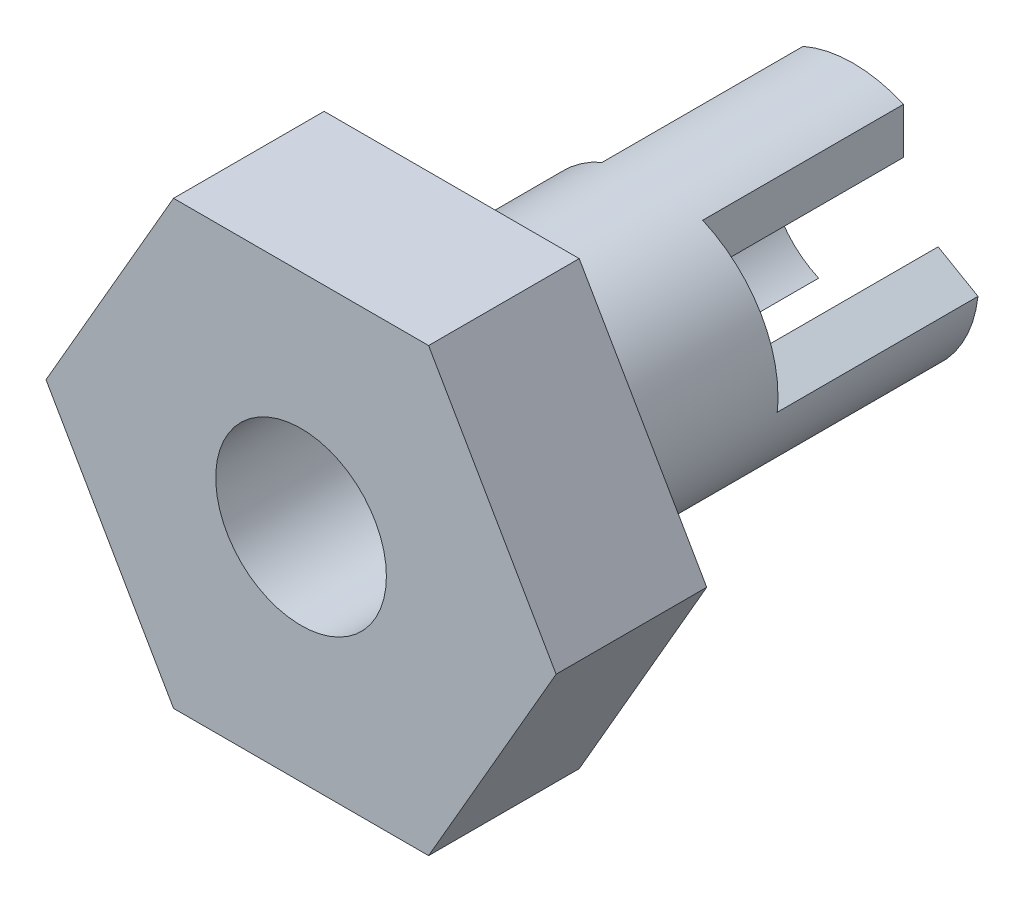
SolidWorks part; units mm, degrees
ref_plane "Front Plane" through (0, 0, 0) normal (0, 0, 1) x (1, 0, 0)
ref_plane "Top Plane" through (0, 0, 0) normal (0, 1, 0) x (1, 0, 0)
ref_plane "Right Plane" through (0, 0, 0) normal (1, 0, 0) x (0, 0, -1)
sketch "Sketch1" plane through (0, 0, 0) normal (0, 0, 1) x (1, 0, 0)
  line L1 (6.4525, 0) -> (3.2262, 5.588)
  line L2 (3.2262, 5.588) -> (-3.2262, 5.588)
  line L3 (-3.2262, 5.588) -> (-6.4525, 0)
  line L4 (-6.4525, 0) -> (-3.2262, -5.588)
  line L5 (-3.2262, -5.588) -> (3.2262, -5.588)
  line L6 (3.2262, -5.588) -> (6.4525, 0)
  circle A0 centre (0, 0) radius 5.588 construction
  dimension "D1" = 11.176
extrude "Boss-Extrude1" add sketch "Sketch1" along normal blind 3.81
sketch "Sketch3" plane through (0, 0, 3.81) normal (0, 0, 1) x (1, 0, 0)
  circle A0 centre (0, 0) radius 2.159
  dimension "D1" = 4.318
extrude "Cut-Extrude1" cut sketch "Sketch3" against normal through all
sketch "Sketch5" plane through (0, 0, 0) normal (0, 0, -1) x (-1, 0, 0)
  circle A0 centre (0, 0) radius 3.175
  circle A1 centre (0, 0) radius 2.159
  dimension "D1" = 6.35
  dimension "D2" = 4.318
extrude "Boss-Extrude2" add sketch "Sketch5" along normal blind 5.08
sketch "Sketch6" plane through (0, 0, -5.08) normal (0, 0, -1) x (-1, 0, 0)
  line L0 (1.27, 2.9099) -> (1.27, 1.746)
  line L1 (-1.27, 2.9099) -> (-1.27, 1.746)
  line L2 (0, 0) -> (0, 4.4171) construction
  line L3 (3.1551, -0.3551) -> (2.147, 0.2269)
  line L4 (1.8851, -2.5548) -> (0.877, -1.9728)
  line L5 (-1.8851, -2.5548) -> (-0.877, -1.9728)
  line L6 (-3.1551, -0.3551) -> (-2.147, 0.2269)
  arc A0 (1.27, 2.9099) -> (-1.27, 2.9099) centre (0, 0) ccw
  arc A1 (1.27, 1.746) -> (-1.27, 1.746) centre (0, 0) ccw
  arc A2 (0.877, -1.9728) -> (2.147, 0.2269) centre (0, 0) ccw
  arc A3 (1.8851, -2.5548) -> (3.1551, -0.3551) centre (0, 0) ccw
  arc A4 (-2.147, 0.2269) -> (-0.877, -1.9728) centre (0, 0) ccw
  arc A5 (-3.1551, -0.3551) -> (-1.8851, -2.5548) centre (0, 0) ccw
  point P17 (0, 0)
  dimension "D4" = 2.159
  dimension "D1" = 1.27
  dimension "D2" = 2.54
  dimension "D3" = 3
extrude "Boss-Extrude3" add sketch "Sketch6" along normal blind 5.08
